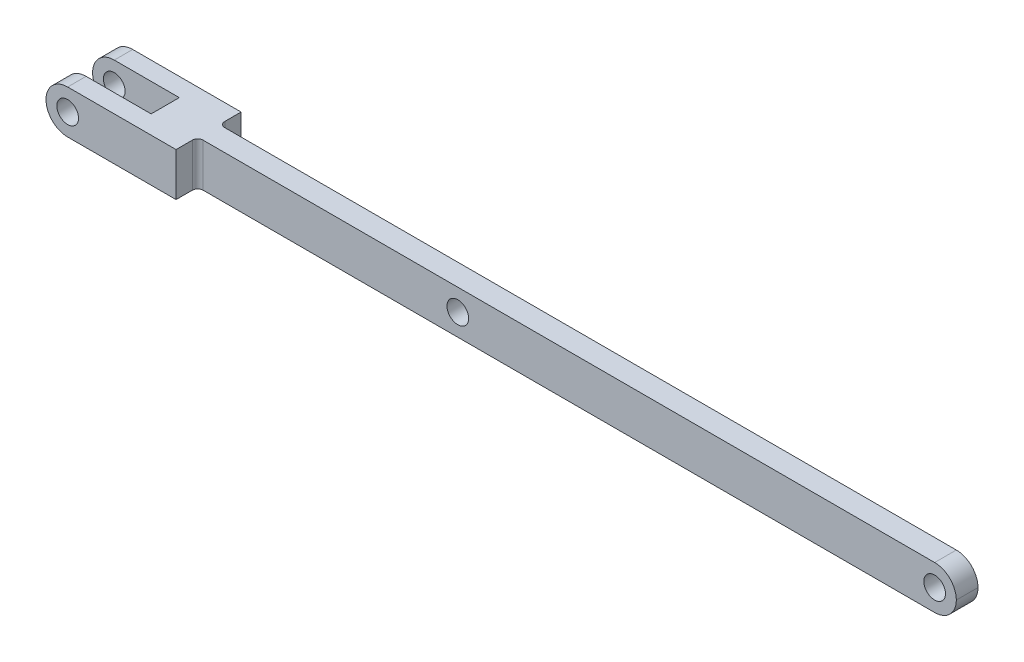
SolidWorks part; units mm, degrees
ref_plane "Front Plane" through (0, 0, 0) normal (0, 0, 1) x (1, 0, 0)
ref_plane "Top Plane" through (0, 0, 0) normal (0, 1, 0) x (1, 0, 0)
ref_plane "Right Plane" through (0, 0, 0) normal (1, 0, 0) x (0, 0, -1)
sketch "Sketch1" plane through (0, 0, 0) normal (0, 0, 1) x (1, 0, 0)
  line L0 (0, 0) -> (122.3606, 0) construction
  line L1 (0, 0) -> (0, 102.2628) construction
  line L2 (0, -20) -> (800, -20)
  line L4 (0, 20) -> (800, 20)
  line L5 (800, -20) -> (800, 20)
  arc A0 (0, 20) -> (0, -20) centre (0, 0) ccw
  dimension "D1" = 40
  dimension "D2" = 20
  dimension "D3" = 800
extrude "Extrude1" add sketch "Sketch1" along normal mid plane 20
sketch "Sketch2" plane through (0, 0, 10) normal (0, 0, 1) x (1, 0, 0)
  line L0 (100, 20) -> (100, -20)
  line L3 (0, -20) -> (800, -20)
  line L4 (800, -20) -> (800, 20)
  line L5 (800, 20) -> (0, 20)
  line L6 (0, -20) -> (100, -20)
  line L8 (100, 20) -> (0, 20)
  arc A1 (0, 20) -> (0, -20) centre (0, 0) ccw
  arc A2 (0, 20) -> (0, -20) centre (0, 0) ccw
  dimension "D2" = 100
  dimension "D1" = 0
extrude "Extrude2" add sketch "Sketch2" along normal blind 20
mirror "Mirror1" about plane through (0, 0, 0) normal (0, 0, 1) of "Extrude2"
sketch "Sketch3" plane through (0, 20, 0) normal (0, 1, 0) x (-1, 0, 0)
  line L0 (0, 0) -> (-125.5352, 0) construction
  line L1 (20, -30) -> (20, 30) construction
  line L2 (20, -13) -> (-60, -13)
  line L3 (20, -13) -> (20, 13)
  line L4 (20, 13) -> (-60, 13)
  line L5 (-60, -13) -> (-60, 13)
  dimension "D1" = 26
  dimension "D2" = 13
  dimension "D3" = 80
extrude "Cut-Extrude1" cut sketch "Sketch3" against normal through all and the other way through all
sketch "Sketch4" plane through (0, 0, 30) normal (0, 0, 1) x (1, 0, 0)
  circle A0 centre (0, 0) radius 10
  dimension "D1" = 20
extrude "Cut-Extrude2" cut sketch "Sketch4" against normal through all
fillet "Fillet1" radius 5 4 edges
sketch "Sketch5" plane through (0, 0, 0) normal (0, 0, 1) x (1, 0, 0)
  line L0 (0, 0) -> (821.1393, 0) construction
  circle A0 centre (340, 0) radius 10
  circle A1 centre (0, 0) radius 10 construction
  dimension "D1" = 20
  dimension "D2" = 340
extrude "Cut-Extrude3" cut sketch "Sketch5" against normal through all and the other way through all
sketch "Sketch6" plane through (0, 0, 10) normal (0, 0, 1) x (1, 0, 0)
  line L0 (800, 0) -> (753.6483, 0) construction
  line L1 (800, -20) -> (800, 20) construction
  line L2 (780, 43.2983) -> (780, -43.5672) construction
  circle A0 centre (780, 0) radius 10
  dimension "D1" = 20
  dimension "D2" = 20
extrude "Cut-Extrude4" cut sketch "Sketch6" against normal through all
fillet "Fillet2" radius 20 6 edges at (800, 0, 10) (800, 0, -10) (800, 20, 0) (800, -20, 0)
